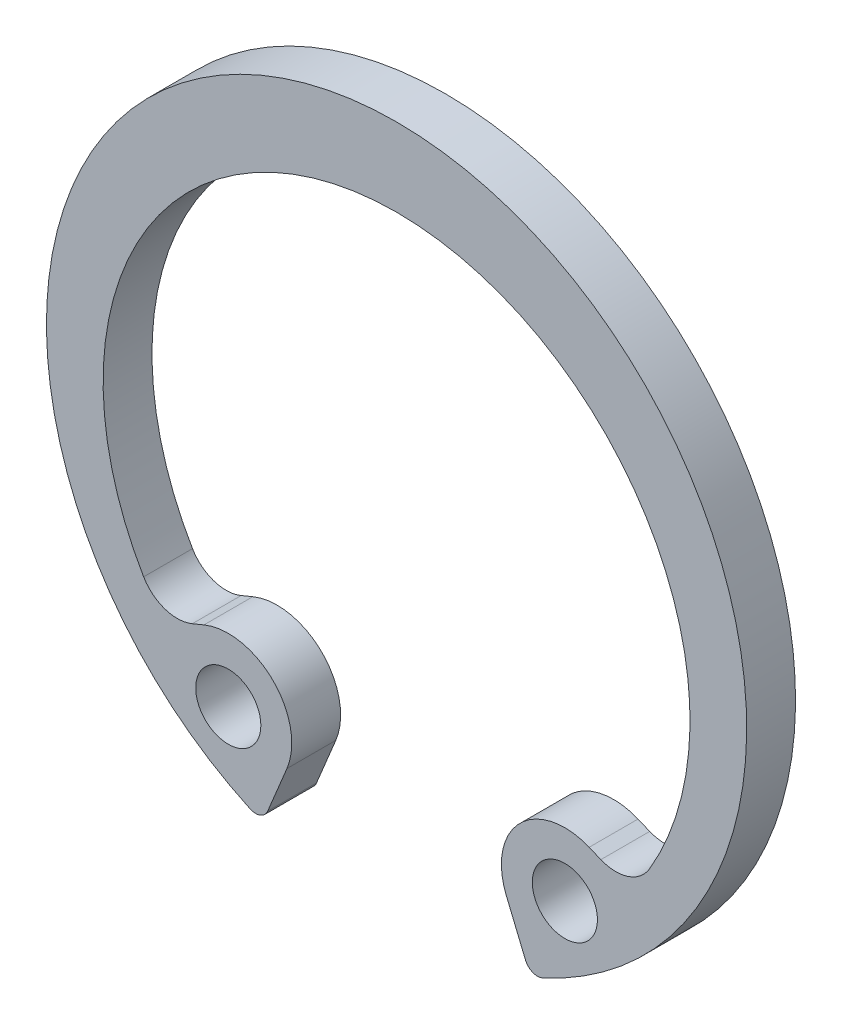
SolidWorks part; units mm, degrees
ref_plane "Front Plane" through (0, 0, 0) normal (0, 0, 1) x (1, 0, 0)
ref_plane "Top Plane" through (0, 0, 0) normal (0, 1, 0) x (1, 0, 0)
ref_plane "Right Plane" through (0, 0, 0) normal (1, 0, 0) x (0, 0, -1)
sketch "BodySke" plane through (0, 0, 0) normal (0, 0, 1) x (1, 0, 0)
  line L0 (0, -7.6074) -> (0, 7.215) construction
  line L1 (3.3663, -8.127) -> (4.1138, -9.9317)
  line L2 (-3.3663, -8.127) -> (-4.1138, -9.9317)
  line L3 (4.1138, -9.9317) -> (5.9992, -9.9317) construction
  line L4 (5.9132, -5.5801) -> (7.179, -6.1044)
  line L5 (-5.9132, -5.5801) -> (-7.179, -6.1044)
  arc A0 (4.1138, -9.9317) -> (-4.1138, -9.9317) centre (0, 0) ccw
  arc A1 (0, -9.67) -> (6.889, -6.467) centre (0, -0.66) ccw construction
  circle A2 centre (5.1673, -7.381) radius 1
  circle A3 centre (0, 0) radius 9.01 construction
  circle A4 centre (-5.1673, -7.381) radius 1
  arc A5 (-7.179, -6.1044) -> (7.179, -6.1044) centre (0, -0.66) cw
  arc A6 (6.889, -6.467) -> (6.6338, -6.0969) centre (5.1673, -7.381) ccw construction
  arc A8 (5.9132, -5.5801) -> (3.3663, -8.127) centre (5.1673, -7.381) ccw
  arc A9 (7.179, -6.1044) -> (-7.179, -6.1044) centre (0, -0.66) ccw
  arc A10 (-5.9132, -5.5801) -> (-3.3663, -8.127) centre (-5.1673, -7.381) cw
  dimension "D1" = 45
  dimension "Groove_Diameter" = 21.5
  dimension "D2" = 22.5
  dimension "D3" = 18.02
  dimension "Hole_dia" = 2
  dimension "Groove_depth" = 2.4
  dimension "Groove_length" = 4.5
extrude "BaseBody" add sketch "BodySke" along normal blind 1.5
fillet "Fillet1" radius 1.2 2 edges at (7.179, -6.1044, 0.75) (-7.179, -6.1044, 0.75)
fillet "Fillet2" radius 0.4 2 edges at (4.1138, -9.9317, 0.75) (-4.1138, -9.9317, 0.75)
equation "\"D3@BodySke\" = \"Groove_Diameter@BodySke\" - 1.45 * \"Groove_depth@BodySke\""
equation "\"D1@Fillet1\" = \"Hole_dia@BodySke\" * 0.6"
equation "\"D1@Fillet2\" = \"Hole_dia@BodySke\" * 0.2"
